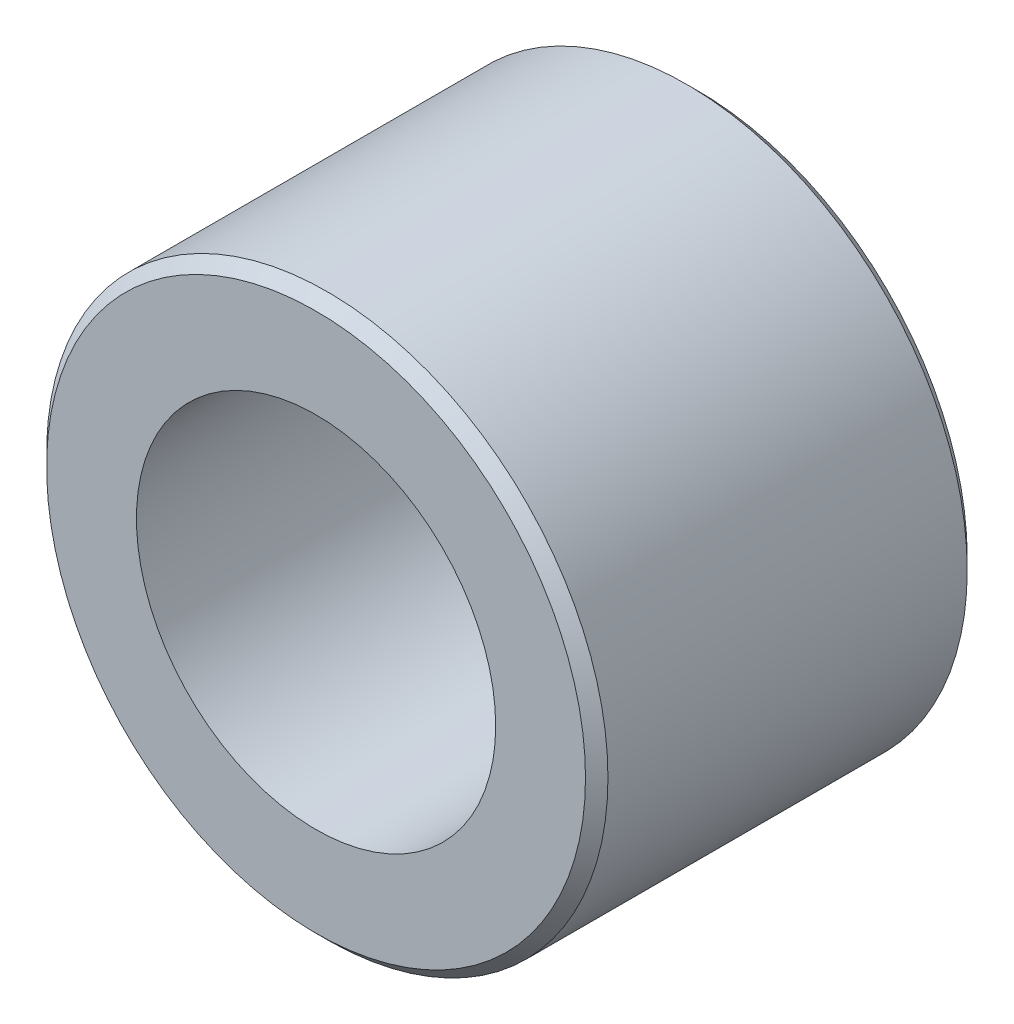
SolidWorks part; units mm, degrees
ref_plane "Plan1" through (0, 0, 0) normal (0, 0, 1) x (1, 0, 0)
ref_plane "Plan2" through (0, 0, 0) normal (0, 1, 0) x (1, 0, 0)
ref_plane "Plan3" through (0, 0, 0) normal (1, 0, 0) x (0, 0, -1)
sketch "Esquisse1" plane through (0, 0, 0) normal (0, 0, 1) x (1, 0, 0)
  circle A0 centre (0, 0) radius 12.5
  circle A1 centre (0, 0) radius 8
  dimension "D1" = 16
  dimension "D2" = 25
extrude "tube" add sketch "Esquisse1" along normal blind 17
chamfer "Chanfrein 0.5x45" distance 0.5 angle 45
